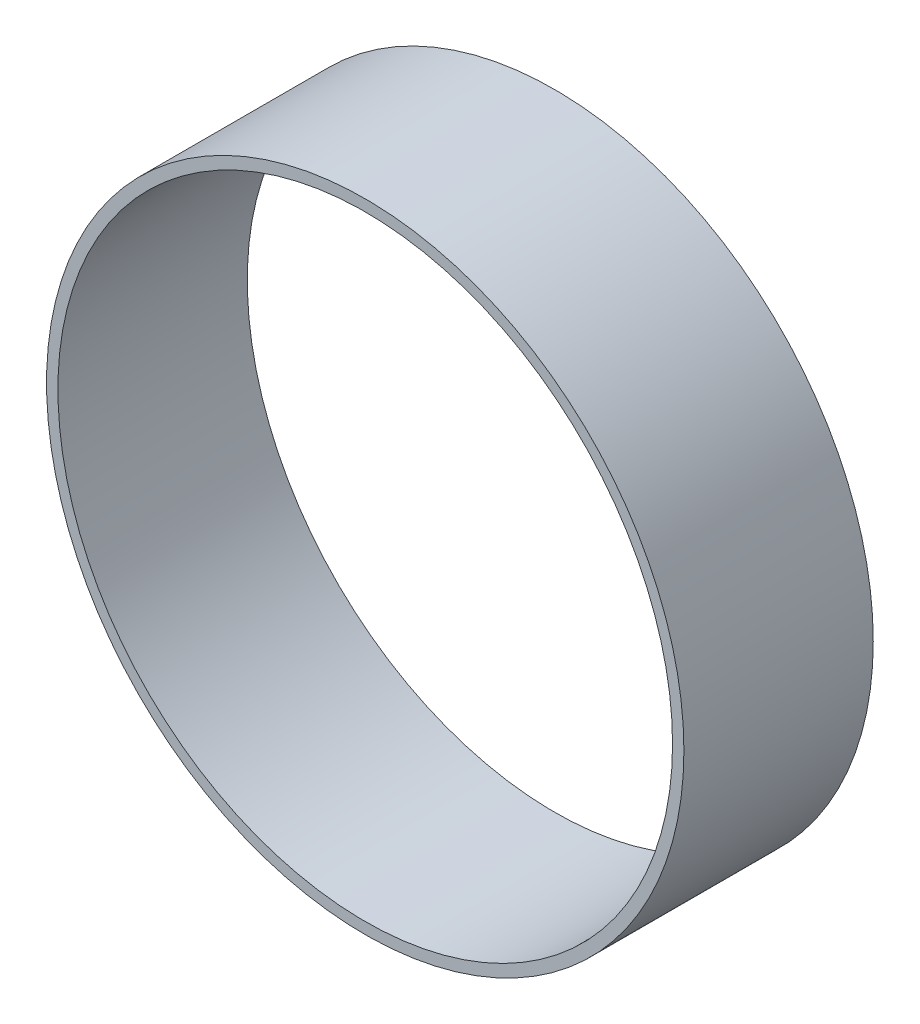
SolidWorks part; units mm, degrees
ref_plane "Plan de face" through (0, 0, 0) normal (0, 0, 1) x (1, 0, 0)
ref_plane "Plan de dessus" through (0, 0, 0) normal (0, 1, 0) x (1, 0, 0)
ref_plane "Plan de droite" through (0, 0, 0) normal (1, 0, 0) x (0, 0, -1)
sketch "Esquisse de tuyau" plane through (0, 0, 0) normal (0, 0, 1) x (1, 0, 0)
  circle A0 centre (0, 0) radius 84.15
  circle A1 centre (0, 0) radius 81.15
  circle A2 centre (0, 0) radius 75 construction
  dimension "D1" = 150
  dimension "Diamètre extérieur" = 168.3
  dimension "Diamètre intérieur" = 162.3
sketch "Esquisse de filtre" plane through (0, 0, 0) normal (0, 1, 0) x (1, 0, 0)
  line L0 (0, 0) -> (0, 50)
  dimension "Diamètre nominal" = 50
sweep "Balayage mince" add profiles "Esquisse de tuyau" path "Esquisse de filtre"
